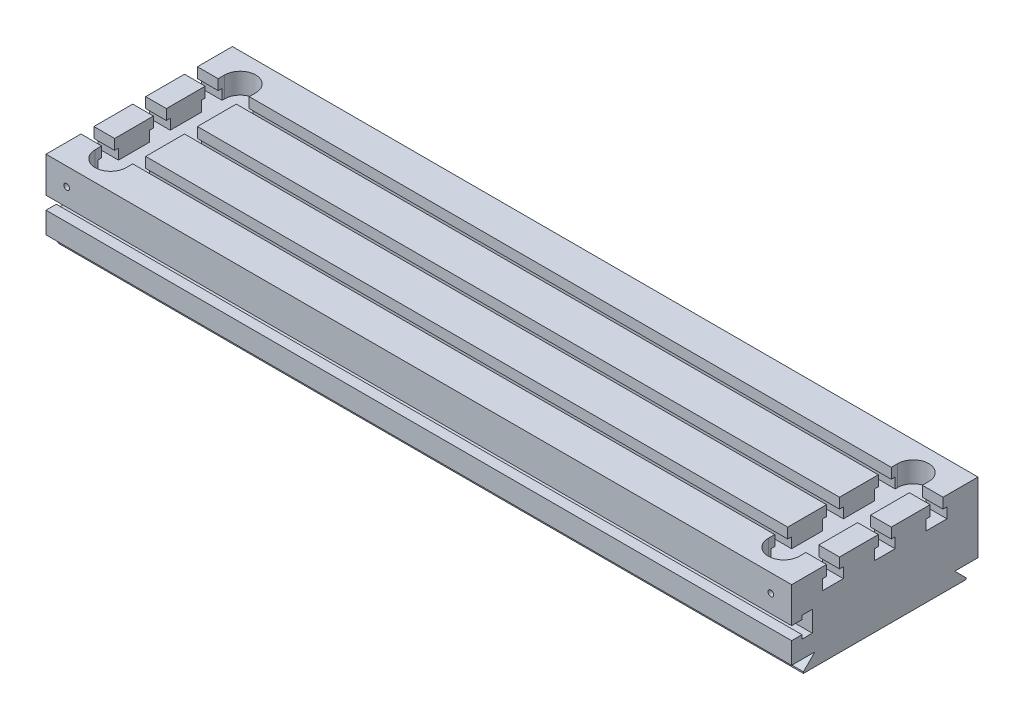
SolidWorks part; units mm, degrees
ref_plane "Front Plane" through (0, 0, 0) normal (0, 0, 1) x (1, 0, 0)
ref_plane "Top Plane" through (0, 0, 0) normal (0, 1, 0) x (1, 0, 0)
ref_plane "Right Plane" through (0, 0, 0) normal (1, 0, 0) x (0, 0, -1)
other "Configuration Table"
sketch "Sketch1" plane through (0, 0, 0) normal (0, 1, 0) x (1, 0, 0)
  line L0 (-457.2, -114.3) -> (457.2, 114.3) construction
  line L1 (-457.2, 114.3) -> (457.2, 114.3)
  line L2 (-457.2, 114.3) -> (-457.2, -114.3)
  line L3 (-457.2, -114.3) -> (457.2, -114.3)
  line L4 (457.2, 114.3) -> (457.2, -114.3)
  dimension "D1" = 914.4
  dimension "D2" = 228.6
extrude "Extrude1" add sketch "Sketch1" against normal blind 85.725
sketch "Sketch2" plane through (0, 0, 0) normal (1, 0, 0) x (0, 0, -1)
  line L0 (-114.3, 0) -> (114.3, 0) construction
  line L9 (12.7, -25.4) -> (12.7, -12.7)
  line L10 (12.7, -12.7) -> (7.9375, -12.7)
  line L11 (-12.7, -25.4) -> (12.7, -25.4)
  line L12 (7.9375, -12.7) -> (7.9375, 0)
  line L13 (-7.9375, 0) -> (-7.9375, -12.7)
  line L14 (-12.7, -12.7) -> (-12.7, -25.4)
  line L15 (7.9375, 0) -> (-7.9375, 0)
  line L16 (-7.9375, -12.7) -> (-12.7, -12.7)
  dimension "D1" = 12.7
  dimension "D2" = 12.7
  dimension "D3" = 25.4
  dimension "D4" = 15.875
extrude "Cut-Extrude1" cut sketch "Sketch2" against normal through all and the other way through all
pattern_linear "LPattern1" count 2 spacing 63.5 along (0, 0, -1) count 2 spacing 63.5 along (0, 0, 1) of "Cut-Extrude1"
sketch "Sketch3" plane through (0, 0, 0) normal (1, 0, 0) x (0, 0, -1)
  line L1 (-114.3, -59.5166) -> (-101.6, -59.5166)
  line L2 (-88.9, -64.2791) -> (-88.9, -38.8791)
  line L3 (-88.9, -38.8791) -> (-101.6, -38.8791)
  line L4 (-114.3, -43.6416) -> (-114.3, -59.5166)
  line L5 (-101.6, -64.2791) -> (-88.9, -64.2791)
  line L6 (-101.6, -59.5166) -> (-101.6, -64.2791)
  line L7 (-101.6, -38.8791) -> (-101.6, -43.6416)
  line L8 (-101.6, -43.6416) -> (-114.3, -43.6416)
  line L9 (-114.3, -85.725) -> (-114.3, 0) construction
  line L13 (-71.4375, 0) -> (-71.4375, -12.7) construction
  line L14 (-76.2, -12.7) -> (-76.2, -25.4) construction
  line L15 (-76.2, -25.4) -> (-50.8, -25.4) construction
  line L16 (-114.3, 0) -> (-71.4375, 0) construction
  dimension "D1" = 43.6416
  dimension "D2" = 15.875
extrude "Cut-Extrude2" cut sketch "Sketch3" against normal through all and the other way through all
sketch "Sketch4" plane through (0, 0, 0) normal (1, 0, 0) x (0, 0, -1)
  line L0 (-85.725, -85.725) -> (-101.6, -101.6)
  line L1 (-114.3, -85.725) -> (114.3, -85.725) construction
  line L2 (-101.6, -101.6) -> (101.6, -101.6)
  line L3 (101.6, -101.6) -> (85.725, -85.725)
  line L4 (0, 0) -> (0, -101.6) construction
  line L41 (-114.3, -43.6416) -> (-101.6, -43.6416)
  line L42 (-101.6, -43.6416) -> (-101.6, -38.8791)
  line L43 (-101.6, -38.8791) -> (-88.9, -38.8791)
  line L44 (-88.9, -38.8791) -> (-88.9, -64.2791)
  line L45 (-88.9, -64.2791) -> (-101.6, -64.2791)
  line L46 (-101.6, -64.2791) -> (-101.6, -59.5166)
  line L47 (-101.6, -59.5166) -> (-114.3, -59.5166)
  line L48 (-114.3, -59.5166) -> (-114.3, -85.725)
  line L49 (-114.3, -85.725) -> (114.3, -85.725)
  line L50 (114.3, -85.725) -> (114.3, 0)
  line L51 (114.3, 0) -> (71.4375, 0)
  line L52 (71.4375, 0) -> (71.4375, -12.7)
  line L53 (71.4375, -12.7) -> (76.2, -12.7)
  line L54 (76.2, -12.7) -> (76.2, -25.4)
  line L55 (76.2, -25.4) -> (50.8, -25.4)
  line L56 (50.8, -25.4) -> (50.8, -12.7)
  line L57 (50.8, -12.7) -> (55.5625, -12.7)
  line L58 (55.5625, -12.7) -> (55.5625, 0)
  line L59 (55.5625, 0) -> (7.9375, 0)
  line L60 (7.9375, 0) -> (7.9375, -12.7)
  line L61 (7.9375, -12.7) -> (12.7, -12.7)
  line L62 (12.7, -12.7) -> (12.7, -25.4)
  line L63 (12.7, -25.4) -> (-12.7, -25.4)
  line L64 (-12.7, -25.4) -> (-12.7, -12.7)
  line L65 (-12.7, -12.7) -> (-7.9375, -12.7)
  line L66 (-7.9375, -12.7) -> (-7.9375, 0)
  line L67 (-7.9375, 0) -> (-55.5625, 0)
  line L68 (-55.5625, 0) -> (-55.5625, -12.7)
  line L69 (-55.5625, -12.7) -> (-50.8, -12.7)
  line L70 (-50.8, -12.7) -> (-50.8, -25.4)
  line L71 (-50.8, -25.4) -> (-76.2, -25.4)
  line L72 (-76.2, -25.4) -> (-76.2, -12.7)
  line L73 (-76.2, -12.7) -> (-71.4375, -12.7)
  line L74 (-71.4375, -12.7) -> (-71.4375, 0)
  line L75 (-71.4375, 0) -> (-114.3, 0)
  line L76 (-114.3, 0) -> (-114.3, -43.6416)
  line L85 (-85.725, -85.725) -> (85.725, -85.725)
  dimension "D1" = 45
  dimension "D2" = 203.2
  dimension "D3" = 15.875
  dimension "D4" = 0
extrude "Extrude2" add sketch "Sketch4" along normal through all and the other way through all
chamfer "Chamfer1" distance 2.54 angle 45 2 edges at (0, -101.6, -101.6) (0, -101.6, 101.6)
sketch "Sketch5" plane through (0, 0, 0) normal (0, 1, 0) x (-1, 0, 0)
  line L0 (393.7, 0) -> (0, 0) construction
  line L1 (457.2, 7.9375) -> (457.2, 55.5625) construction
  line L2 (431.8, -79.375) -> (431.8, 79.375)
  line L4 (393.7, -79.375) -> (393.7, 79.375)
  arc A0 (431.8, -79.375) -> (393.7, -79.375) centre (412.75, -79.375) cw
  arc A1 (431.8, 79.375) -> (393.7, 79.375) centre (412.75, 79.375) ccw
  dimension "D1" = 158.75
  dimension "D2" = 38.1
  dimension "D3" = 25.4
extrude "Cut-Extrude3" cut sketch "Sketch5" against normal up to surface (25.4 mm away)
mirror "Mirror1" about plane through (0, 0, 0) normal (1, 0, 0) of "Cut-Extrude3"
hole_wizard "M8x1.0 Tapped Hole1" positions "3DSketch1" profile "Sketch6" tap size "M8x1.0" standard "Ansi Metric"
sketch3d "3DSketch1"
  line L0 (-457.2, -43.6416, 114.3) -> (-457.2, 0, 114.3) construction
  line L1 (457.2, -43.6416, 114.3) -> (457.2, 0, 114.3) construction
  line L2 (-457.2, 0, 114.3) -> (457.2, 0, 114.3) construction
  point P0 (431.8, -22, 114.3)
  point P4 (-431.8, -22, 114.3)
  dimension "D1" = 25.4
  dimension "D2" = 25.4
  dimension "D3" = 22
sketch "Sketch6" plane through (431.8, -22, 114.3) normal (1, 0, 0) x (0, -1, 0)
  line L0 (0, 0) -> (0, 20.103)
  line L1 (0, 20.103) -> (3.5, 18)
  line L2 (3.5, 18) -> (3.5, 0)
  line L5 (3.5, 0) -> (0, 0)
  line L10 (0, 20.103) -> (-3.5, 18) construction
  line L11 (0, -6.35) -> (0, 107.95) construction
  dimension "Tap Drill Dia." = 7
  dimension "Tap Drill Depth" = 18
  dimension "Drill Angle" = 118
mirror "Mirror2" about plane through (0, 0, 0) normal (0, 0, 1) of "M8x1.0 Tapped Hole1"
